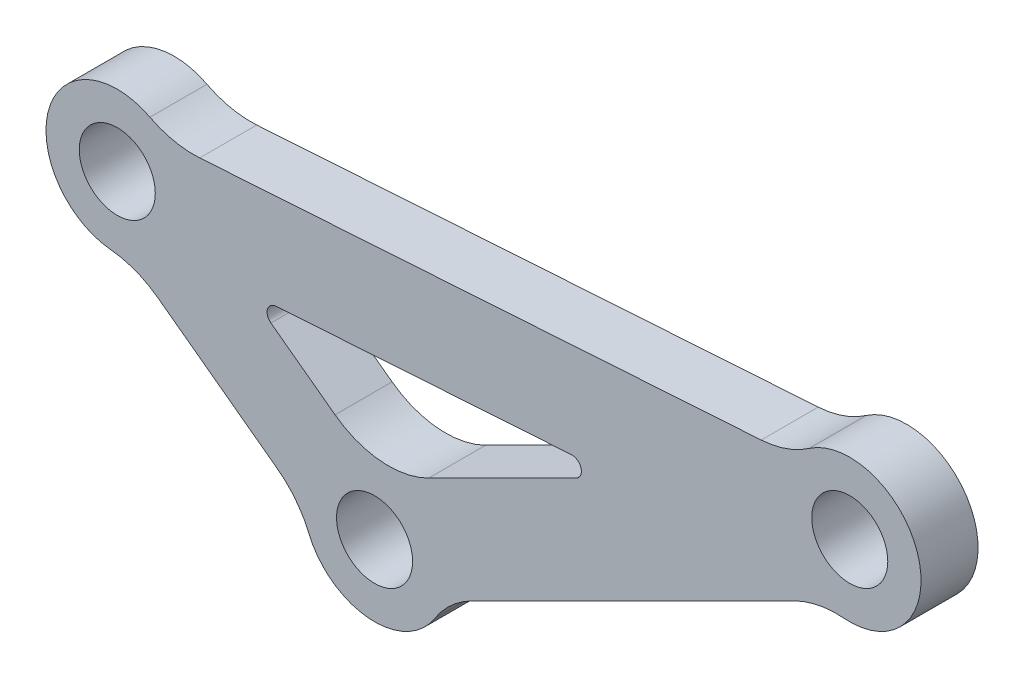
SolidWorks part; units mm, degrees
ref_plane "Alzado" through (0, 0, 0) normal (0, 0, 1) x (1, 0, 0)
ref_plane "Planta" through (0, 0, 0) normal (0, 1, 0) x (1, 0, 0)
ref_plane "Vista lateral" through (0, 0, 0) normal (1, 0, 0) x (0, 0, -1)
sketch "Croquis2" plane through (0, 0, 0) normal (0, 0, 1) x (1, 0, 0)
  line L0 (0, 0) -> (50, 25) construction
  line L1 (50, 25) -> (50, 0) construction
  line L2 (50, 0) -> (0, 0) construction
  line L3 (0, 0) -> (-27.0711, 0) construction
  line L4 (-27.0711, 0) -> (-27.0711, 20) construction
  line L5 (-27.0711, 20) -> (0, 0) construction
  line L6 (-18.3998, 25.5731) -> (40.6813, 29.406)
  line L7 (44.1738, 16.4967) -> (10.2983, -0.441)
  line L8 (-10.221, 1.3347) -> (-22.7922, 10.6223)
  line L9 (-27.0711, 20) -> (50, 25) construction
  line L10 (-10.9016, 14.2706) -> (-4.1559, 9.2869)
  line L11 (5.6895, 8.4349) -> (21.2123, 16.1963)
  line L12 (-10.3721, 16.0728) -> (20.7004, 18.0887)
  circle A0 centre (0, 0) radius 4
  circle A1 centre (50, 25) radius 4
  circle A2 centre (-27.0711, 20) radius 4
  arc A3 (-6.9271, -2.875) -> (6.3302, -4.0223) centre (0, 0) ccw
  arc A4 (49.4197, 17.5225) -> (45.7288, 31.165) centre (50, 25) ccw
  arc A5 (-23.6323, 26.6652) -> (-27.7839, 12.534) centre (-27.0711, 20) ccw
  arc A6 (-23.6323, 26.6652) -> (-18.3998, 25.5731) centre (-19.0472, 35.5521) ccw
  arc A7 (45.7288, 31.165) -> (40.6813, 29.406) centre (40.0339, 39.385) cw
  arc A8 (49.4197, 17.5225) -> (44.1738, 16.4967) centre (48.6459, 7.5525) ccw
  arc A9 (6.3302, -4.0223) -> (10.2983, -0.441) centre (14.7705, -9.3853) cw
  arc A10 (-6.9271, -2.875) -> (-10.221, 1.3347) centre (-16.1632, -6.7084) ccw
  arc A11 (-27.7839, 12.534) -> (-22.7922, 10.6223) centre (-28.7344, 2.5792) cw
  arc A12 (-4.1559, 9.2869) -> (5.6895, 8.4349) centre (1.4617, 16.8907) ccw
  arc A13 (-10.3721, 16.0728) -> (-10.9016, 14.2706) centre (-10.3074, 15.0749) ccw
  arc A14 (20.7004, 18.0887) -> (21.2123, 16.1963) centre (20.7651, 17.0908) cw
  arc A15 (-19.5868, 20.4855) -> (-23.6323, 26.6652) centre (-27.0711, 20) ccw construction
  arc A16 (-21.0388, 15.5434) -> (-19.5868, 20.4855) centre (-27.0711, 20) ccw construction
  arc A17 (-27.0711, 12.5) -> (-21.0388, 15.5434) centre (-27.0711, 20) ccw construction
  arc A18 (-6.0323, 4.4566) -> (-7.5, 0) centre (0, 0) ccw construction
  arc A19 (0.6466, 7.4721) -> (-6.0323, 4.4566) centre (0, 0) ccw construction
  arc A20 (-7.5, 0) -> (-6.9271, -2.875) centre (0, 0) ccw construction
  arc A21 (7.5, 0) -> (6.7082, 3.3541) centre (0, 0) ccw construction
  arc A22 (6.7082, 3.3541) -> (0.6466, 7.4721) centre (0, 0) ccw construction
  arc A23 (6.3302, -4.0223) -> (7.5, 0) centre (0, 0) ccw construction
  arc A24 (42.5157, 24.5145) -> (43.2918, 21.6459) centre (50, 25) ccw construction
  arc A25 (45.7288, 31.165) -> (42.5157, 24.5145) centre (50, 25) ccw construction
  arc A26 (43.2918, 21.6459) -> (49.4197, 17.5225) centre (50, 25) ccw construction
  arc A27 (-27.7839, 12.534) -> (-27.0711, 12.5) centre (-27.0711, 20) ccw construction
  dimension "D3" = 8
  dimension "D6" = 15
  dimension "D7" = 10
  dimension "D8" = 10
  dimension "D14" = 1
  dimension "D15" = 7.5
  dimension "D1" = 50
  dimension "D2" = 25
  dimension "D4" = 27.0711
  dimension "D5" = 20
  dimension "D9" = 5
  dimension "D10" = 5
  dimension "D11" = 10
  dimension "D12" = 10
  dimension "D13" = 10
extrude "Saliente-Extruir1" add sketch "Croquis2" along normal mid plane 6
